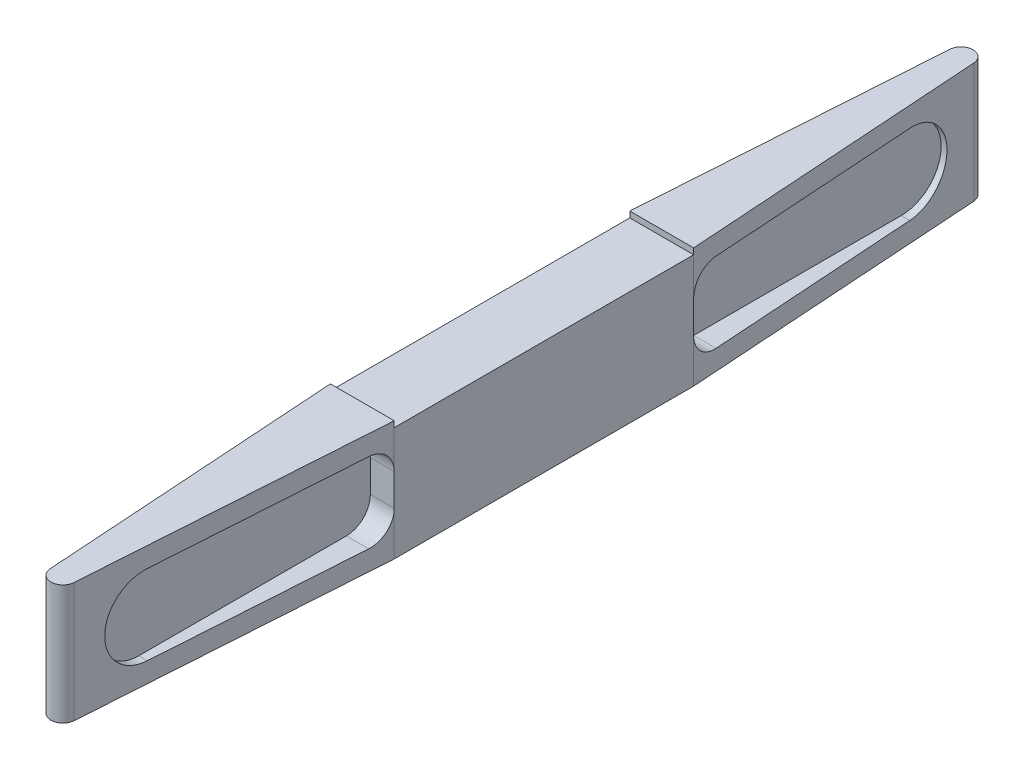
SolidWorks part; units mm, degrees
ref_plane "Front" through (0, 0, 0) normal (0, 0, 1) x (1, 0, 0)
ref_plane "Top" through (0, 0, 0) normal (0, 1, 0) x (1, 0, 0)
ref_plane "Right" through (0, 0, 0) normal (1, 0, 0) x (0, 0, -1)
sketch "Sketch1" plane through (0, 0, 0) normal (0, 1, 0) x (1, 0, 0)
  line L0 (0, 0) -> (55.1982, 0) construction
  line L1 (0, 0) -> (0, 49.235) construction
  line L2 (8, 37.5) -> (2.9934, 112.6993)
  line L3 (-8, 37.5) -> (-2.9934, 112.6993)
  line L4 (8, 37.5) -> (8, -37.5)
  line L5 (-8, 37.5) -> (-8, -37.5)
  line L6 (-8, -37.5) -> (-2.9934, -112.6993)
  line L7 (8, -37.5) -> (2.9934, -112.6993)
  arc A0 (-2.9934, 112.6993) -> (2.9934, 112.6993) centre (0, 112.5) cw
  arc A1 (-2.9934, -112.6993) -> (2.9934, -112.6993) centre (0, -112.5) ccw
  point P15 (-8, 0)
  point P16 (8, 0)
  dimension "D2" = 3
  dimension "D1" = 225
  dimension "D3" = 75
  dimension "D4" = 16
extrude "Base-Extrude" add sketch "Sketch1" along normal blind 30
sketch "Sketch2" plane through (8, 0, 0) normal (1, 0, 0) x (0, 0, -1)
  line L0 (-37.5, 15) -> (-127.9941, 15) construction
  line L1 (-37.5, 30) -> (-37.5, 0) construction
  line L2 (-37.5, 5) -> (-95.5, 5)
  line L3 (-37.5, 25) -> (-95.5, 25)
  line L4 (-115.5, 30) -> (-115.5, 0) construction
  line L5 (-37.5, 25) -> (-37.5, 5)
  arc A0 (-95.5, 5) -> (-95.5, 25) centre (-95.5, 15) cw
  dimension "D1" = 10
  dimension "D2" = 20
extrude "Cut-Extrude1" cut sketch "Sketch2" against normal blind 6
fillet "Fillet1" radius 6 2 edges at (5, 25, 37.5) (5, 5, 37.5)
mirror "Mirror1" about plane through (0, 0, 0) normal (1, 0, 0) of "Fillet1", "Cut-Extrude1"
mirror "Mirror2" about plane through (0, 0, 0) normal (0, 0, 1) of "Mirror1", "Cut-Extrude1", "Fillet1"
sketch "Sketch5" plane through (0, 30, 0) normal (0, 1, 0) x (-1, 0, 0)
  line L0 (8, 37.5) -> (-8, 37.5)
  line L1 (8, 37.5) -> (8, -37.5)
  line L2 (-8, -37.5) -> (8, -37.5)
  line L3 (-8, -37.5) -> (-8, 37.5)
  line L4 (0, 0) -> (0, -42.9632) construction
  line L5 (8, -37.5) -> (8, 37.5) construction
  line L6 (-8, -37.5) -> (-8, 37.5) construction
extrude "Cut-Extrude3" cut sketch "Sketch5" against normal blind 1.5
